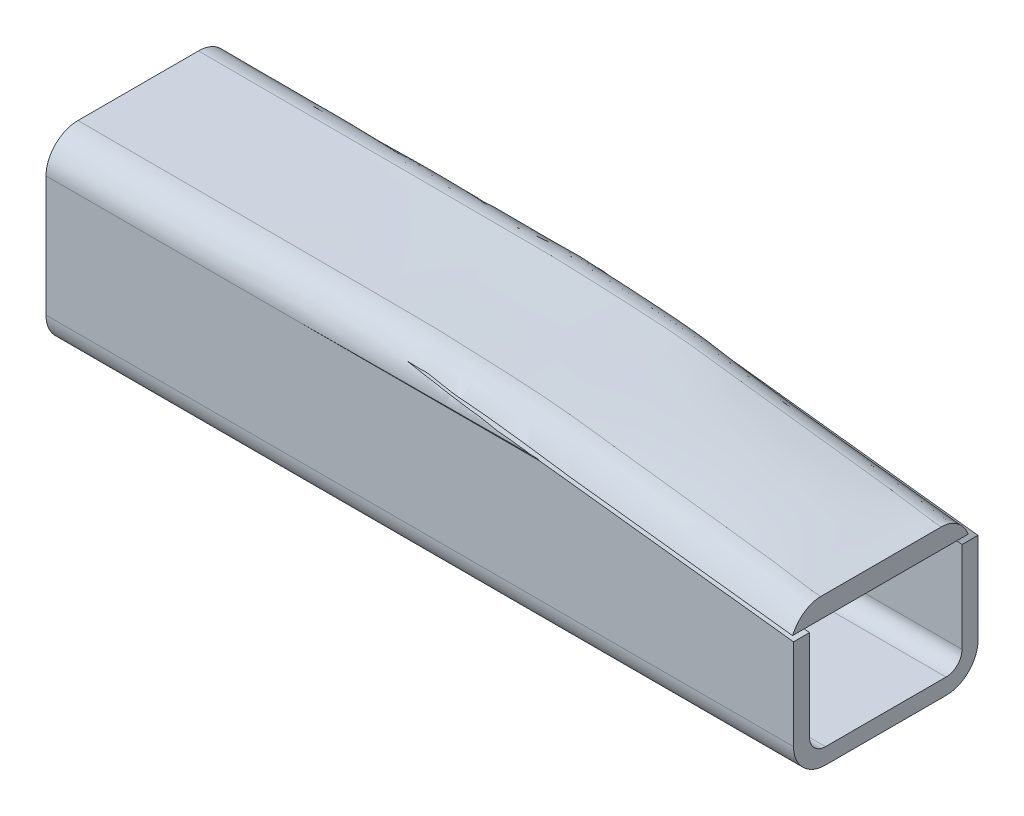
SolidWorks part; units mm, degrees
ref_plane "Ebene vorne" through (0, 0, 0) normal (0, 0, 1) x (1, 0, 0)
ref_plane "Ebene oben" through (0, 0, 0) normal (0, 1, 0) x (1, 0, 0)
ref_plane "Ebene rechts" through (0, 0, 0) normal (1, 0, 0) x (0, 0, -1)
sketch "Skizze1" plane through (0, 0, 0) normal (0, 0, 1) x (1, 0, 0)
  line L0 (0, 0) -> (121.5752, 0)
other "Strukturbauteil1"
ref_plane "Ebene1" through (0, 0, 0) normal (1, 0, 0) x (0, 0, 1)
sketch "Sketch1" plane through (0, 0, 0) normal (1, 0, 0) x (0, 0, 1)
  line L0 (-9.8, -12.4) -> (9.8, -12.4)
  line L1 (-12.4, -9.8) -> (-12.4, 9.8)
  line L2 (9.8, 12.4) -> (-9.8, 12.4)
  line L3 (12.4, 9.8) -> (12.4, -9.8)
  line L4 (-9.8, -15) -> (9.8, -15)
  line L5 (-15, -9.8) -> (-15, 9.8)
  line L6 (9.8, 15) -> (-9.8, 15)
  line L7 (15, 9.8) -> (15, -9.8)
  arc A0 (15, 9.8) -> (9.8, 15) centre (9.8, 9.8) ccw
  arc A1 (9.8, -15) -> (15, -9.8) centre (9.8, -9.8) ccw
  arc A2 (-15, -9.8) -> (-9.8, -15) centre (-9.8, -9.8) ccw
  arc A3 (-9.8, 15) -> (-15, 9.8) centre (-9.8, 9.8) ccw
  arc A4 (-9.8, 12.4) -> (-12.4, 9.8) centre (-9.8, 9.8) ccw
  arc A5 (12.4, 9.8) -> (9.8, 12.4) centre (9.8, 9.8) ccw
  arc A6 (9.8, -12.4) -> (12.4, -9.8) centre (9.8, -9.8) ccw
  arc A7 (-12.4, -9.8) -> (-9.8, -12.4) centre (-9.8, -9.8) ccw
  point P0 (-15, 0)
  point P1 (15, 0)
  point P2 (0, 15)
  point P3 (0, -15)
  point P4 (0, 0)
  point P5 (-15, -15)
  point P6 (15, -15)
  point P7 (15, 15)
  point P8 (-15, 15)
  point P33 (0, 0)
  dimension "D1" = 5.2
  dimension "Thickness" = 2.6
  dimension "V_leg" = 30
sketch "Skizze3" plane through (0, 0, 15) normal (0, 0, 1) x (1, 0, 0)
  line L0 (58.0354, 12.4) -> (121.5752, 12.4)
  line L1 (121.5752, 12.4) -> (121.5752, 4.9583)
  line L2 (121.5752, 4.9583) -> (58.0354, 12.4)
  arc A0 (121.1439, 5.0089) -> (121.5752, 12.4) centre (58.0354, 12.4) ccw construction
extrude "Schnitt-Linear austragen1" cut sketch "Skizze3" against normal through all
sketch "Skizze14" plane through (0, 12.4, 0) normal (0, -1, 0) x (1, 0, 0)
  line L0 (58.0354, 14.3033) -> (121.5752, 14.3033)
  line L1 (121.5752, 14.3033) -> (121.5752, -14.3033)
  line L2 (121.5752, -14.3033) -> (58.0354, -14.3033)
ref_plane "Ebene4" through (2.2179, 18.9372, 0) normal (0.1163, 0.9932, 0) x (-0.9932, 0.1163, 0)
sketch "Skizze15" plane through (2.2179, 18.9372, 0) normal (0.1163, 0.9932, 0) x (-0.9932, 0.1163, 0)
  line L0 (-56.1991, 14.3033) -> (-119.3075, 14.3033) construction
  line L1 (-119.3075, 14.3033) -> (-119.3075, -14.3033) construction
  line L2 (-119.3075, -14.3033) -> (-56.1991, -14.3033) construction
  line L3 (-56.1991, 14.3033) -> (-119.3075, 14.3033)
  line L4 (-119.3075, 14.3033) -> (-119.3075, -14.3033)
  line L5 (-119.3075, -14.3033) -> (-56.1991, -14.3033)
other "Verformen3" parameters "D1"=50, "D2"=50, "Dicke"=2.6
equation "\"LÄNGE\"=0"
equation "\"BREITE\"=0"
equation "\"HÖHE\"=0"
equation "\"DURCHMESSER\"=0"
equation "\"Stückzahl\"= 1"
